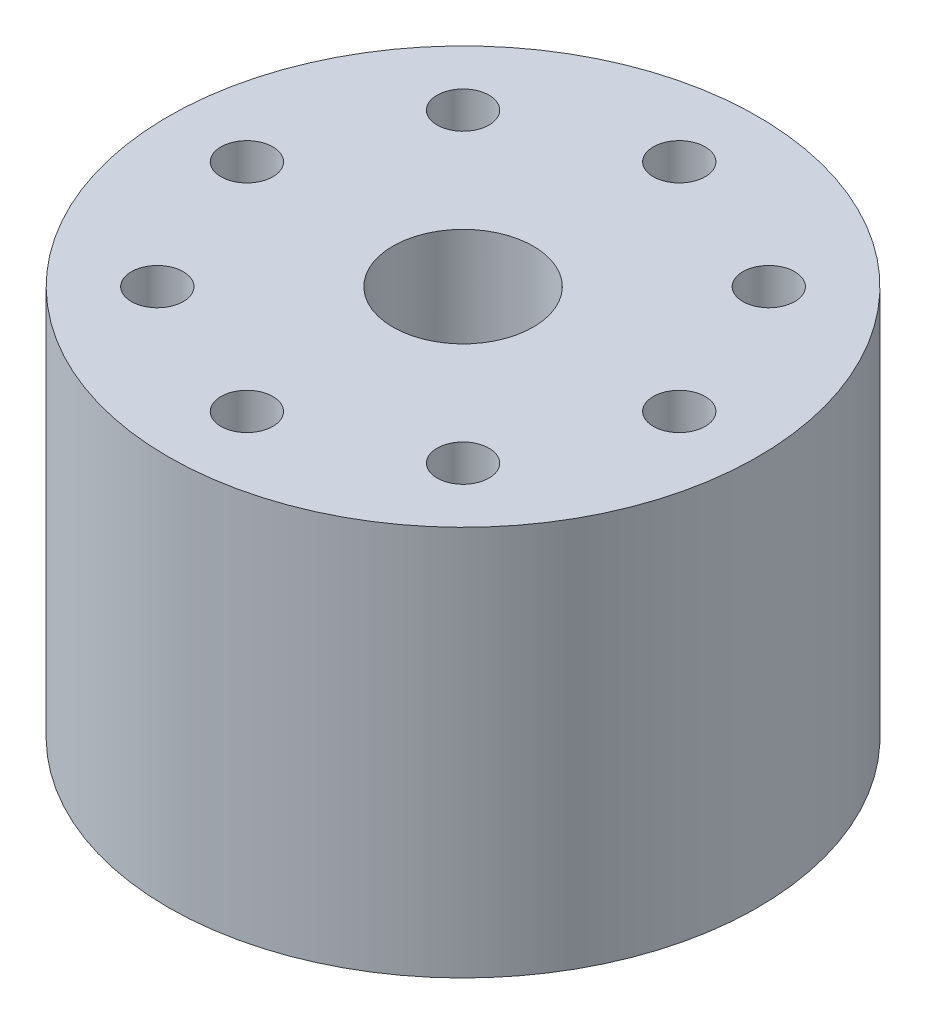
SolidWorks part; units mm, degrees
ref_plane "Front Plane" through (0, 0, 0) normal (0, 0, 1) x (1, 0, 0)
ref_plane "Top Plane" through (0, 0, 0) normal (0, 1, 0) x (1, 0, 0)
ref_plane "Right Plane" through (0, 0, 0) normal (1, 0, 0) x (0, 0, -1)
sketch "Sketch1" plane through (0, 0, 0) normal (0, 1, 0) x (1, 0, 0)
  circle A0 centre (0, 0) radius 37.5
  dimension "D1" = 75
extrude "Outer Cylinder" add sketch "Sketch1" along normal blind 49.65
sketch "Sketch2" plane through (0, 49.65, 0) normal (0, 1, 0) x (1, 0, 0)
  circle A0 centre (0, 0) radius 8.93
  dimension "D1" = 17.86
extrude "NPT Hole" cut sketch "Sketch2" against normal blind 23
sketch "Sketch3" plane through (0, 0, 0) normal (0, -1, 0) x (1, 0, 0)
  circle A0 centre (0, 0) radius 14
  dimension "D1" = 28
extrude "Outer Leaflet Diameter" cut sketch "Sketch3" against normal blind 5
sketch "Sketch4" plane through (0, 0, 0) normal (0, -1, 0) x (1, 0, 0)
  circle A0 centre (0, 0) radius 18
  dimension "D1" = 36
extrude "Depth" cut sketch "Sketch4" against normal blind 3.15
ref_plane "Plane1" through (0, 3.15, 0) normal (0, -1, 0) x (-1, 0, 0)
sketch "Sketch6" plane through (0, 0, 0) normal (0, 0, 1) x (1, 0, 0)
  line L0 (0, 3.15) -> (-14, 3.15)
  line L1 (-18, 3.15) -> (18, 3.15) construction
  line L2 (0, 3.15) -> (0, 23.03)
  line L3 (0, 23.03) -> (-14, 23.03)
  spline S0 degree 2 poles (-14, 23.03) (-22.4, 13.09) (-14, 3.15) knots 0 0 0 1 1 1
revolve "Aortic Root" cut sketch "Sketch6" angle 360 about L2
ref_plane "Plane3" through (0, 26.65, 0) normal (0, 1, 0) x (1, 0, 0)
ref_plane "Plane5" through (0, 23.03, 0) normal (0, -1, 0) x (-1, 0, 0)
sketch "Sketch8" plane through (0, 0, 0) normal (0, 0, 1) x (1, 0, 0)
  line L0 (0, 26.65) -> (0, 23.03)
  line L1 (8.93, 26.65) -> (-8.93, 26.65) construction
  line L2 (-14, 23.03) -> (14, 23.03) construction
  line L3 (0, 23.03) -> (-14, 23.03)
  line L4 (-14, 23.03) -> (-14, 26.65)
  line L5 (-14, 26.65) -> (0, 26.65)
revolve "Ascending Aorta" cut sketch "Sketch8" angle 360 about L0
sketch "Sketch9" plane through (0, 49.65, 0) normal (0, 1, 0) x (1, 0, 0)
  line L0 (0, 0) -> (0, -27.5) construction
  line L1 (0, 0) -> (-19.4454, -19.4454) construction
  circle A0 centre (0, -27.5) radius 3.3
  circle A1 centre (0, 0) radius 27.5
  circle A2 centre (-19.4454, -19.4454) radius 3.3
  circle A3 centre (-27.5, 0) radius 3.3
  circle A4 centre (-19.4454, 19.4454) radius 3.3
  circle A5 centre (0, 27.5) radius 3.3
  circle A6 centre (19.4454, 19.4454) radius 3.3
  circle A7 centre (27.5, 0) radius 3.3
  circle A8 centre (19.4454, -19.4454) radius 3.3
  dimension "D1" = 6.6
  dimension "D3" = 55
  dimension "D2" = 27.5
  dimension "D5" = 45
  dimension "D4" = 8
extrude "Bolt Holes" cut sketch "Sketch9" against normal through all contours A1 A8 | A1 A7 | A1 A6 | A1 A6 | A1 A5 | A1 A5 | A1 A4 | A1 A4 | A1 A3 | A1 A3 | A1 A2 | A1 A2 | A0 A1 | A1 A0 | A1 A8
chamfer "Chamfer3" distance 5 angle 50 1 edges at (0, 26.65, 8.93)
equation "\"A\"= 28"
equation "\"Outer Leaflet Diameter\"= \"A\""
equation "\"Aortic Root Height\"= .71 * \"A\""
equation "\"D2@Sketch6\"=\"A\"/2"
equation "\"D3@Sketch6\"= \"A\" / 2"
equation "\"Max Diameter Height\"= \"A\" * ( .71 / 2 )"
equation "\"Max Diameter\"= \"A\" * ( .65 )"
equation "\"D2@Sketch8\"=\"A\"/2"
